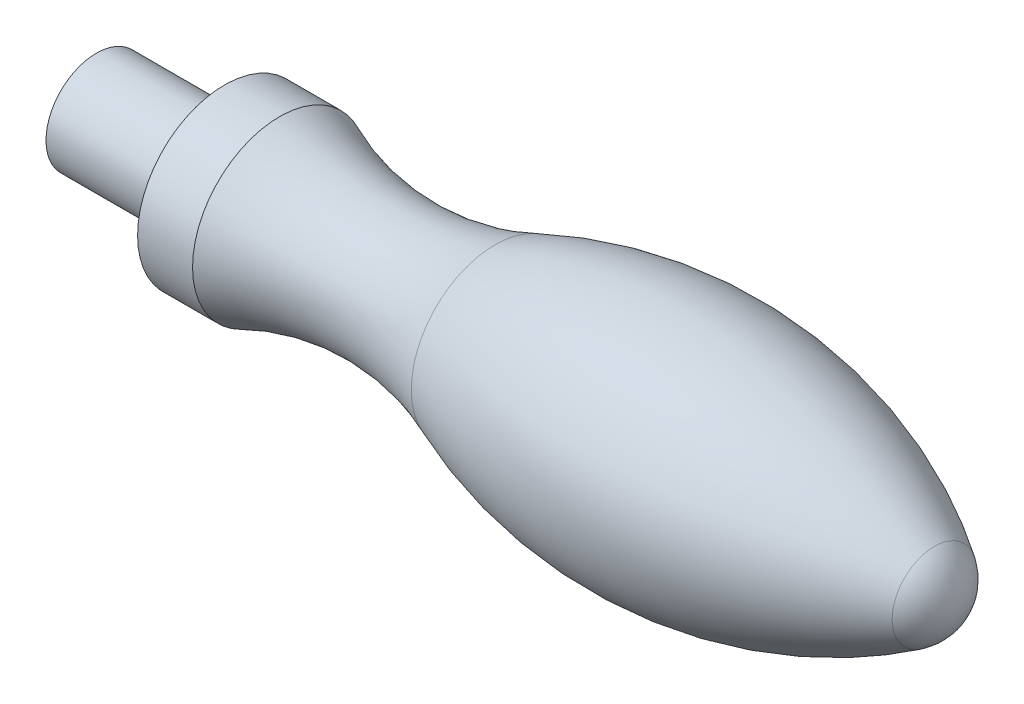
SolidWorks part; units mm, degrees
ref_plane "前视基准面" through (0, 0, 0) normal (0, 0, 1) x (1, 0, 0)
ref_plane "上视基准面" through (0, 0, 0) normal (0, 1, 0) x (1, 0, 0)
ref_plane "右视基准面" through (0, 0, 0) normal (1, 0, 0) x (0, 0, -1)
sketch "草图1" plane through (0, 0, 0) normal (0, 0, 1) x (1, 0, 0)
  line L0 (-77.7984, 0) -> (88.9657, 0) construction
  line L1 (-76.5883, 0) -> (-76.5883, 5.5)
  line L2 (-76.5883, 5.5) -> (-62.5883, 5.5)
  line L3 (-62.5883, 5.5) -> (-62.5883, 9.5)
  line L4 (-62.5883, 9.5) -> (-56.5883, 9.5)
  line L5 (-11.9117, 13) -> (48.3914, 13) construction
  line L6 (-76.5883, 0) -> (17.4117, 0)
  arc A0 (-56.5883, 9.5) -> (-33.0674, 9.1418) centre (-44.4076, 36.9159) ccw
  arc A1 (-33.0674, 9.1418) -> (14.9069, 4.6129) centre (-13.4112, -39) cw
  arc A2 (14.9069, 4.6129) -> (17.4117, 0) centre (11.9117, 0) cw
  dimension "D5" = 30
  dimension "D6" = 52
  dimension "D7" = 13
  dimension "D8" = 5.5
  dimension "D1" = 5.5
  dimension "D2" = 14
  dimension "D3" = 4
  dimension "D4" = 6
  dimension "D9" = 94
revolve "旋转1" add sketch "草图1" angle 360 about L6
